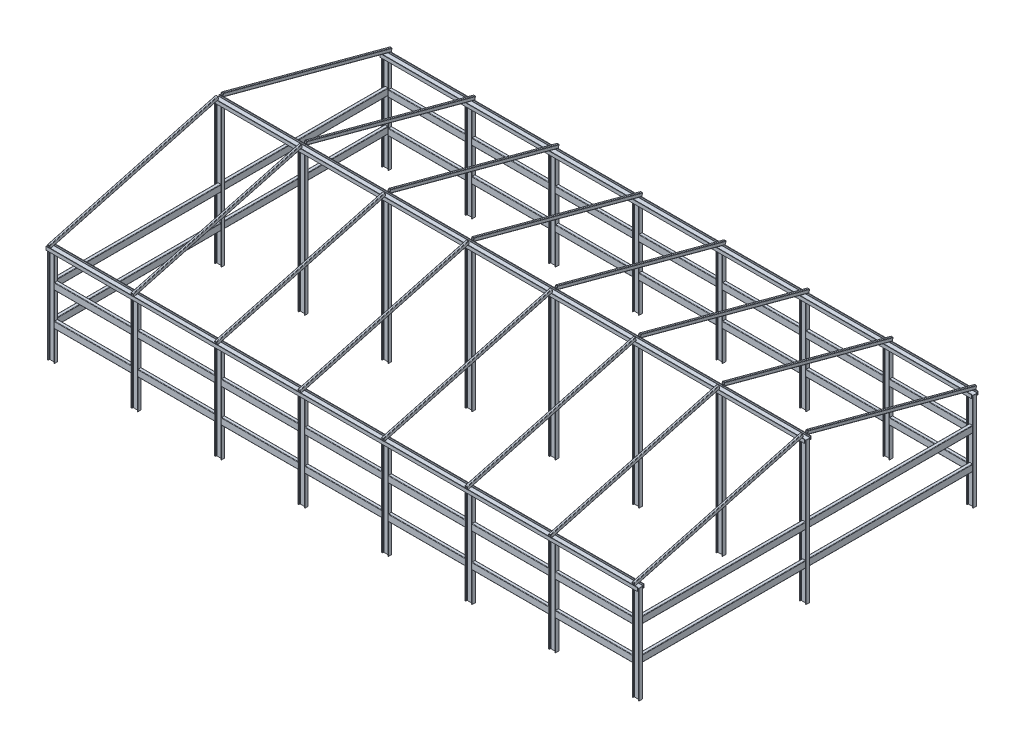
SolidWorks part; units mm, degrees
ref_plane "Front" through (0, 0, 0) normal (0, 0, 1) x (1, 0, 0)
ref_plane "Base Plane" through (0, 0, 0) normal (0, 1, 0) x (1, 0, 0)
ref_plane "Back Plane" through (0, 0, 0) normal (1, 0, 0) x (0, 0, -1)
sketch "Sketch1" plane through (0, 0, 0) normal (0, 1, 0) x (1, 0, 0)
  point P0 (0, 0)
  point P3 (21000, 3000)
  point P4 (3000, 0)
  point P5 (21000, 9000)
  point P6 (6000, 0)
  point P7 (9000, 0)
  point P8 (12000, 0)
  point P9 (15000, 0)
  point P10 (18000, 0)
  point P11 (21000, 0)
  point P12 (6000, 3000)
  point P13 (9000, 3000)
  point P14 (12000, 3000)
  point P15 (15000, 3000)
  point P16 (18000, 3000)
  point P17 (3000, 9000)
  point P19 (3000, 6000)
  point P20 (6000, 6000)
  point P21 (9000, 6000)
  point P23 (12000, 6000)
  point P24 (15000, 6000)
  point P25 (18000, 6000)
  point P26 (21000, 6000)
  point P27 (6000, 9000)
  point P28 (9000, 9000)
  point P29 (12000, 9000)
  point P30 (15000, 9000)
  point P31 (18000, 9000)
  point P32 (0, 3000)
  point P35 (0, 6000)
  point P37 (0, 12000)
  point P38 (3000, 12000)
  point P39 (6000, 12000)
  point P40 (9000, 12000)
  point P41 (12000, 12000)
  point P42 (15000, 12000)
  point P43 (18000, 12000)
  point P44 (21000, 12000)
  point P45 (3000, 3000)
  point P46 (0, 9000)
  dimension "D1" = 8
  dimension "D2" = 5
ref_plane "Front plane" through (21000, 0, 0) normal (1, 0, 0) x (0, 0, -1)
sketch "Sketch15" plane through (0, 0, 0) normal (1, 0, 0) x (0, 0, -1)
  line L0 (0, 3500) -> (6000, 5107.6952)
  line L1 (6000, 5107.6952) -> (12000, 3500)
  line L2 (6000, 1650) -> (6000, -1650) construction
  line L3 (0, 50) -> (0, -50) construction
  dimension "D1" = 75
surface "Roof Surface 1" sketch "Sketch15"
sketch "Sketch124" plane through (21000, 0, 0) normal (1, 0, 0) x (0, 0, -1)
  line L0 (6000, 1650) -> (6000, -1650) construction
  line L1 (-120, 3557.977) -> (-120, 0) construction
  line L2 (-120, 3557.977) -> (5880, 5167.6952)
  line L3 (5880, 5214.4961) -> (5880, 5056.8765) construction
  line L4 (12120, 3557.977) -> (6120, 5167.6952)
  line L5 (6120, 5214.4961) -> (6120, 5056.8765) construction
  line L6 (5880, 5167.6952) -> (5928.2922, 5180.6513)
  line L7 (6120, 5167.6952) -> (6071.7078, 5180.6513)
  point P0 (-120, 3557.977)
  point P1 (6000, 5167.7)
  point P2 (6000, 0)
  dimension "D1" = 3560
  dimension "D2" = 5167.7
  dimension "D3" = 6120
  dimension "D4" = 120
  dimension "D5" = 120
  dimension "D6" = 60
  dimension "D7" = 60
  dimension "D8" = 50
  dimension "D9" = 50
surface "Roof Surface 2" sketch "Sketch124" parameters "D1"=21277, "D2"=50
ref_plane "Top plane" through (0, 3500, 0) normal (0, 1, 0) x (1, 0, 0)
ref_plane "Central Plane" through (0, 0, -6000) normal (0, 0, 1) x (1, 0, 0)
ref_plane "Summit Plane" through (0, 5107.6952, 0) normal (0, 1, 0) x (1, 0, 0)
sketch "Sketch3" plane through (0, 3500, 0) normal (0, 1, 0) x (1, 0, 0)
  point P0 (6000, 6000)
  point P2 (9000, 6000)
  point P4 (12000, 6000)
  point P6 (15000, 6000)
  point P8 (18000, 6000)
  point P10 (21000, 6000)
  point P12 (21000, 3000)
  point P14 (15000, 0)
  point P16 (18000, 0)
  point P18 (21000, 0)
  point P20 (12000, 0)
  point P22 (9000, 0)
  point P24 (6000, 0)
  point P26 (3000, 0)
  point P28 (0, 0)
  point P30 (0, 3000)
  point P32 (3000, 6000)
  point P34 (0, 6000)
  point P36 (0, 9000)
  point P38 (21000, 9000)
  point P40 (0, 12000)
  point P42 (3000, 12000)
  point P44 (6000, 12000)
  point P46 (9000, 12000)
  point P48 (12000, 12000)
  point P50 (15000, 12000)
  point P52 (18000, 12000)
  point P54 (21000, 12000)
ref_plane "V Intermediate Plane 1" through (18000, 0, 0) normal (1, 0, 0) x (0, 0, -1)
ref_plane "V Intermediate Plane 2" through (15000, 0, 0) normal (1, 0, 0) x (0, 0, -1)
ref_plane "V Intermediate Plane 3" through (12000, 0, 0) normal (1, 0, 0) x (0, 0, -1)
ref_plane "V Intermediate Plane 4" through (9000, 0, 0) normal (1, 0, 0) x (0, 0, -1)
ref_plane "V Intermediate Plane 5" through (6000, 0, 0) normal (1, 0, 0) x (0, 0, -1)
ref_plane "V Intermediate Plane 6" through (3000, 0, 0) normal (1, 0, 0) x (0, 0, -1)
ref_plane "H Intermediate Plane 1" through (0, 2400, 0) normal (0, 1, 0) x (1, 0, 0)
ref_plane "H Intermediate Plane 2" through (0, 1200, 0) normal (0, 1, 0) x (1, 0, 0)
ref_plane "Plane30" through (21000, 3615.9276, 135.5474) normal (0, -0.2591, 0.9658) x (1, 0, 0)
sketch "Sketch139" plane through (21000, 3615.9276, 135.5474) normal (0, -0.2591, 0.9658) x (1, 0, 0)
  line L0 (-24, -52) -> (24, -52)
  line L1 (-32, -44) -> (-32, 44)
  line L2 (24, 52) -> (-24, 52)
  line L3 (32, 44) -> (32, -44)
  line L4 (-24, -60) -> (24, -60)
  line L5 (-40, -44) -> (-40, 44)
  line L6 (24, 60) -> (-24, 60)
  line L7 (40, 44) -> (40, -44)
  arc A0 (40, 44) -> (24, 60) centre (24, 44) ccw
  arc A1 (24, -60) -> (40, -44) centre (24, -44) ccw
  arc A2 (-40, -44) -> (-24, -60) centre (-24, -44) ccw
  arc A3 (-24, 60) -> (-40, 44) centre (-24, 44) ccw
  arc A4 (-24, 52) -> (-32, 44) centre (-24, 44) ccw
  arc A5 (32, 44) -> (24, 52) centre (24, 44) ccw
  arc A6 (24, -52) -> (32, -44) centre (24, -44) ccw
  arc A7 (-32, -44) -> (-24, -52) centre (-24, -44) ccw
  point P0 (0, 60)
  point P1 (40, 0)
  point P2 (0, -60)
  point P3 (-40, 0)
  point P4 (-40, 60)
  point P5 (40, 60)
  point P6 (40, -60)
  point P7 (-40, -60)
  point P8 (0, 0)
  point P33 (0, 0)
  dimension "D1" = 16
  dimension "Thickness" = 8
  dimension "V_leg" = 120
  dimension "H_leg" = 80
other "Structure System1"
sketch3d "Structure System Grid7"
  line L0 (21000, 0, -12000) -> (21000, 3500, -12000)
  line L1 (18000, 0, -12000) -> (18000, 3500, -12000)
  line L2 (15000, 0, -12000) -> (15000, 3500, -12000)
  line L3 (12000, 0, -12000) -> (12000, 3500, -12000)
  line L4 (9000, 0, -12000) -> (9000, 3500, -12000)
  line L5 (6000, 0, -12000) -> (6000, 3500, -12000)
  line L6 (3000, 0, -12000) -> (3000, 3500, -12000)
  line L7 (0, 0, -12000) -> (0, 3500, -12000)
  line L8 (21000, 0, 0) -> (21000, 3500, 0)
  line L9 (18000, 0, 0) -> (18000, 3500, 0)
  line L10 (15000, 0, 0) -> (15000, 3500, 0)
  line L11 (12000, 0, 0) -> (12000, 3500, 0)
  line L12 (9000, 0, 0) -> (9000, 3500, 0)
  line L13 (6000, 0, 0) -> (6000, 3500, 0)
  line L14 (3000, 0, 0) -> (3000, 3500, 0)
  line L15 (0, 0, 0) -> (0, 3500, 0)
  line L16 (21000, 5107.6952, -6000) -> (21000, 0, -6000)
  line L17 (18000, 5107.6952, -6000) -> (18000, 0, -6000)
  line L18 (15000, 5107.6952, -6000) -> (15000, 0, -6000)
  line L19 (12000, 5107.6952, -6000) -> (12000, 0, -6000)
  line L20 (9000, 5107.6952, -6000) -> (9000, 0, -6000)
  line L21 (6000, 5107.6952, -6000) -> (6000, 0, -6000)
  line L22 (3000, 5107.6952, -6000) -> (3000, 0, -6000)
  line L23 (0, 5107.6952, -6000) -> (0, 0, -6000)
  line L24 (21000, 2400, 0) -> (21000, 2400, -6000)
  line L25 (21000, 1200, 0) -> (21000, 1200, -6000)
  line L26 (21000, 2400, -6000) -> (21000, 2400, -12000)
  line L27 (21000, 1200, -6000) -> (21000, 1200, -12000)
  line L28 (21000, 2400, -12000) -> (18000, 2400, -12000)
  line L29 (21000, 1200, -12000) -> (18000, 1200, -12000)
  line L30 (18000, 2400, -12000) -> (15000, 2400, -12000)
  line L31 (18000, 1200, -12000) -> (15000, 1200, -12000)
  line L32 (15000, 2400, -12000) -> (12000, 2400, -12000)
  line L33 (15000, 1200, -12000) -> (12000, 1200, -12000)
  line L34 (12000, 2400, -12000) -> (9000, 2400, -12000)
  line L35 (12000, 1200, -12000) -> (9000, 1200, -12000)
  line L36 (9000, 2400, -12000) -> (6000, 2400, -12000)
  line L37 (9000, 1200, -12000) -> (6000, 1200, -12000)
  line L38 (6000, 2400, -12000) -> (3000, 2400, -12000)
  line L39 (6000, 1200, -12000) -> (3000, 1200, -12000)
  line L40 (3000, 2400, -12000) -> (0, 2400, -12000)
  line L41 (3000, 1200, -12000) -> (0, 1200, -12000)
  line L42 (0, 2400, -12000) -> (0, 2400, -6000)
  line L43 (0, 1200, -12000) -> (0, 1200, -6000)
  line L44 (0, 2400, -6000) -> (0, 2400, 0)
  line L45 (0, 1200, -6000) -> (0, 1200, 0)
  line L46 (0, 2400, 0) -> (3000, 2400, 0)
  line L47 (0, 1200, 0) -> (3000, 1200, 0)
  line L48 (3000, 2400, 0) -> (6000, 2400, 0)
  line L49 (3000, 1200, 0) -> (6000, 1200, 0)
  line L50 (6000, 2400, 0) -> (9000, 2400, 0)
  line L51 (6000, 1200, 0) -> (9000, 1200, 0)
  line L52 (9000, 2400, 0) -> (12000, 2400, 0)
  line L53 (9000, 1200, 0) -> (12000, 1200, 0)
  line L54 (12000, 2400, 0) -> (15000, 2400, 0)
  line L55 (12000, 1200, 0) -> (15000, 1200, 0)
  line L56 (15000, 2400, 0) -> (18000, 2400, 0)
  line L57 (15000, 1200, 0) -> (18000, 1200, 0)
  line L58 (18000, 2400, 0) -> (21000, 2400, 0)
  line L59 (18000, 1200, 0) -> (21000, 1200, 0)
  line L61 (-120, 5107.6952, -6000) -> (21120, 5107.6952, -6000)
  line L62 (-120, 3500, -12000) -> (21120, 3500, -12000)
  line L63 (21000, 3615.9276, 135.5474) -> (21000, 5238.602, -5912.7448)
  line L64 (21000, 5238.602, -6087.2552) -> (21000, 3615.9276, -12135.5474)
  line L65 (18000, 3615.9276, 135.5474) -> (18000, 5238.602, -5912.7448)
  line L66 (18000, 5238.602, -6087.2552) -> (18000, 3615.9276, -12135.5474)
  line L67 (15000, 3615.9276, 135.5474) -> (15000, 5238.602, -5912.7448)
  line L68 (15000, 5238.602, -6087.2552) -> (15000, 3615.9276, -12135.5474)
  line L69 (12000, 3615.9276, 135.5474) -> (12000, 5238.602, -5912.7448)
  line L70 (12000, 5238.602, -6087.2552) -> (12000, 3615.9276, -12135.5474)
  line L71 (9000, 3615.9276, 135.5474) -> (9000, 5238.602, -5912.7448)
  line L72 (9000, 5238.602, -6087.2552) -> (9000, 3615.9276, -12135.5474)
  line L73 (6000, 3615.9276, 135.5474) -> (6000, 5238.602, -5912.7448)
  line L74 (6000, 5238.602, -6087.2552) -> (6000, 3615.9276, -12135.5474)
  line L75 (3000, 3615.9276, 135.5474) -> (3000, 5238.602, -5912.7448)
  line L76 (3000, 5238.602, -6087.2552) -> (3000, 3615.9276, -12135.5474)
  line L77 (0, 3615.9276, 135.5474) -> (0, 5238.602, -5912.7448)
  line L78 (0, 5238.602, -6087.2552) -> (0, 3615.9276, -12135.5474)
  line L79 (-120, 3500, 0) -> (21120, 3500, 0)
  line L80 (-120, 5107.6952, -6000) -> (21120, 5107.6952, -6000)
  line L81 (-120, 3500, -12000) -> (21120, 3500, -12000)
  line L83 (21000, 5238.602, -6087.2552) -> (21000, 3615.9276, -12135.5474)
  line L84 (18000, 3615.9276, 135.5474) -> (18000, 5238.602, -5912.7448)
  line L85 (18000, 5238.602, -6087.2552) -> (18000, 3615.9276, -12135.5474)
  line L86 (15000, 3615.9276, 135.5474) -> (15000, 5238.602, -5912.7448)
  line L87 (15000, 5238.602, -6087.2552) -> (15000, 3615.9276, -12135.5474)
  line L88 (12000, 3615.9276, 135.5474) -> (12000, 5238.602, -5912.7448)
  line L89 (12000, 5238.602, -6087.2552) -> (12000, 3615.9276, -12135.5474)
  line L90 (9000, 3615.9276, 135.5474) -> (9000, 5238.602, -5912.7448)
  line L91 (9000, 5238.602, -6087.2552) -> (9000, 3615.9276, -12135.5474)
  line L92 (6000, 3615.9276, 135.5474) -> (6000, 5238.602, -5912.7448)
  line L93 (6000, 5238.602, -6087.2552) -> (6000, 3615.9276, -12135.5474)
  line L94 (3000, 3615.9276, 135.5474) -> (3000, 5238.602, -5912.7448)
  line L95 (3000, 5238.602, -6087.2552) -> (3000, 3615.9276, -12135.5474)
  line L96 (0, 3615.9276, 135.5474) -> (0, 5238.602, -5912.7448)
  line L97 (0, 5238.602, -6087.2552) -> (0, 3615.9276, -12135.5474)
other "<iso><sb beam><240X24>(3)"
ref_plane "Plane28" through (21000, 0, -12000) normal (0, 1, 0) x (0, 0, -1)
sketch "Sketch137" plane through (21000, 0, -12000) normal (0, 1, 0) x (0, 0, -1)
  line L0 (-60, -120) -> (-60, -105.666)
  line L1 (-56.6576, -101.7204) -> (-18.6847, -95.3911)
  line L2 (-12, -87.5) -> (-12, 87.5)
  line L3 (-18.6847, 95.3911) -> (-56.6576, 101.7204)
  line L4 (-60, 105.666) -> (-60, 120)
  line L5 (-60, 120) -> (60, 120)
  line L6 (60, 120) -> (60, 105.666)
  line L7 (56.6576, 101.7204) -> (18.6847, 95.3911)
  line L8 (12, 87.5) -> (12, -87.5)
  line L9 (18.6847, -95.3911) -> (56.6576, -101.7204)
  line L10 (60, -105.666) -> (60, -120)
  line L11 (60, -120) -> (-60, -120)
  line L15 (-12, 0) -> (12, 0) construction
  arc A0 (-18.6847, -95.3911) -> (-12, -87.5) centre (-20, -87.5) ccw
  arc A1 (-12, 87.5) -> (-18.6847, 95.3911) centre (-20, 87.5) ccw
  arc A2 (18.6847, 95.3911) -> (12, 87.5) centre (20, 87.5) ccw
  arc A3 (12, -87.5) -> (18.6847, -95.3911) centre (20, -87.5) ccw
  arc A4 (-56.6576, 101.7204) -> (-60, 105.666) centre (-56, 105.666) cw
  arc A5 (56.6576, 101.7204) -> (60, 105.666) centre (56, 105.666) ccw
  arc A6 (-60, -105.666) -> (-56.6576, -101.7204) centre (-56, -105.666) cw
  arc A7 (60, -105.666) -> (56.6576, -101.7204) centre (56, -105.666) ccw
  point P1 (0, 120)
  point P8 (0, -120)
  point P21 (0, 0)
  point P34 (0, 0)
  dimension "RI" = 8
  dimension "D3" = 4
  dimension "BF" = 120
  dimension "D2" = 9.463
  dimension "DEPTH" = 240
  dimension "TW" = 24
  dimension "D1" = 175
other "Member175"
other "Member176"
other "Member177"
other "Member178"
other "Member179"
other "Member180"
other "Member181"
other "Member182"
other "Member183"
other "Member184"
other "Member185"
other "Member186"
other "Member187"
other "Member188"
other "Member189"
other "Member190"
other "Member191"
other "Member192"
other "Member193"
other "Member194"
other "Member195"
other "Member196"
other "Member197"
other "Member198"
other "Member236" [suppressed]
other "Member237" [suppressed]
other "Member254"
other "Member255"
other "Member256"
other "<iso><rectangular tube><240 X 120 X 12>(3)"
ref_plane "Plane29" through (21000, 2400, 0) normal (0, 0, -1) x (-1, 0, 0)
sketch "Sketch138" plane through (21000, 2400, 0) normal (0, 0, -1) x (-1, 0, 0)
  line L0 (-44, -108) -> (44, -108)
  line L1 (-48, -104) -> (-48, 104)
  line L2 (44, 108) -> (-44, 108)
  line L3 (48, 104) -> (48, -104)
  line L4 (-44, -120) -> (44, -120)
  line L5 (-60, -104) -> (-60, 104)
  line L6 (44, 120) -> (-44, 120)
  line L7 (60, 104) -> (60, -104)
  arc A0 (60, 104) -> (44, 120) centre (44, 104) ccw
  arc A1 (44, -120) -> (60, -104) centre (44, -104) ccw
  arc A2 (-60, -104) -> (-44, -120) centre (-44, -104) ccw
  arc A3 (-44, 120) -> (-60, 104) centre (-44, 104) ccw
  arc A4 (-44, 108) -> (-48, 104) centre (-44, 104) ccw
  arc A5 (48, 104) -> (44, 108) centre (44, 104) ccw
  arc A6 (44, -108) -> (48, -104) centre (44, -104) ccw
  arc A7 (-48, -104) -> (-44, -108) centre (-44, -104) ccw
  point P0 (0, 120)
  point P1 (60, 0)
  point P2 (0, -120)
  point P3 (-60, 0)
  point P4 (-60, 120)
  point P5 (60, 120)
  point P6 (60, -120)
  point P7 (-60, -120)
  point P8 (0, 0)
  point P33 (0, 0)
  dimension "D1" = 16
  dimension "Thickness" = 12
  dimension "V_leg" = 240
  dimension "H_leg" = 120
other "Member199"
other "Member200"
other "Member201"
other "Member202"
other "Member203"
other "Member204"
other "Member205"
other "Member206"
other "Member207"
other "Member208"
other "Member209"
other "Member210"
other "Member211"
other "Member212"
other "Member213"
other "Member214"
other "Member215"
other "Member216"
other "Member217"
other "Member218"
other "Member219"
other "Member220"
other "Member221"
other "Member222"
other "Member223"
other "Member224"
other "Member225"
other "Member226"
other "Member227"
other "Member228"
other "Member229"
other "Member230"
other "Member231"
other "Member232"
other "Member233"
other "Member234"
other "<iso><rectangular tube><120 x 80 x 8>(4)"
other "Member238"
other "Member239"
other "Member240"
other "Member241"
other "Member242"
other "Member243"
other "Member244"
other "Member245"
other "Member246"
other "Member247"
other "Member248"
other "Member249"
other "Member250"
other "Member251"
other "Member252"
other "Member253"
other "<iso><rectangular tube><120 x 80 x 8>(5)"
ref_plane "Plane32" through (21000, 5238.602, -6087.2552) normal (0, 0.2591, 0.9658) x (1, 0, 0)
sketch "Sketch142" plane through (21000, 5238.602, -6087.2552) normal (0, 0.2591, 0.9658) x (1, 0, 0)
  line L0 (-24, -52) -> (24, -52)
  line L1 (-32, -44) -> (-32, 44)
  line L2 (24, 52) -> (-24, 52)
  line L3 (32, 44) -> (32, -44)
  line L4 (-24, -60) -> (24, -60)
  line L5 (-40, -44) -> (-40, 44)
  line L6 (24, 60) -> (-24, 60)
  line L7 (40, 44) -> (40, -44)
  arc A0 (40, 44) -> (24, 60) centre (24, 44) ccw
  arc A1 (24, -60) -> (40, -44) centre (24, -44) ccw
  arc A2 (-40, -44) -> (-24, -60) centre (-24, -44) ccw
  arc A3 (-24, 60) -> (-40, 44) centre (-24, 44) ccw
  arc A4 (-24, 52) -> (-32, 44) centre (-24, 44) ccw
  arc A5 (32, 44) -> (24, 52) centre (24, 44) ccw
  arc A6 (24, -52) -> (32, -44) centre (24, -44) ccw
  arc A7 (-32, -44) -> (-24, -52) centre (-24, -44) ccw
  point P0 (0, 60)
  point P1 (40, 0)
  point P2 (0, -60)
  point P3 (-40, 0)
  point P4 (-40, 60)
  point P5 (40, 60)
  point P6 (40, -60)
  point P7 (-40, -60)
  point P8 (0, 0)
  point P33 (0, 0)
  dimension "D1" = 16
  dimension "Thickness" = 8
  dimension "V_leg" = 120
  dimension "H_leg" = 80
other "Member258"
other "Member259"
other "Member260"
other "Member261"
other "Member262"
other "Member263"
other "Member264"
other "Member265"
other "Member266"
other "Member267"
other "Member268"
other "Member269"
other "Member270"
other "Member271"
other "Member272"
other "Corner Management1"
other "Complex Corner Group3"
other "Corner121"
other "Corner122"
other "Corner123"
other "Corner124"
other "Corner125"
other "Corner126"
other "Corner127"
other "Corner128"
other "Corner129"
other "Corner130" [suppressed]
other "Corner131"
other "Corner132"
other "Corner133"
other "Corner134"
other "Corner135"
other "Corner136" [suppressed]
other "Corner137"
other "Corner138"
other "Corner139" [suppressed]
other "Corner140" [suppressed]
other "Corner141"
other "Corner142"
other "Corner143"
other "Corner144" [suppressed]
other "Corner145" [suppressed]
other "Corner146"
other "Corner147"
other "Corner148"
other "Corner149" [suppressed]
other "Corner150"
other "Corner151"
other "Corner152"
other "Corner153"
other "Corner154"
other "Corner155"
other "Corner156"
other "Simple Corner Group3"
other "Corner157" [suppressed]
other "Corner158" [suppressed]
other "Corner163" [suppressed]
other "Corner164" [suppressed]
other "Corner165" [suppressed]
other "Corner166" [suppressed]
other "Corner167" [suppressed]
other "Corner168" [suppressed]
other "Corner172" [suppressed]
other "Corner173" [suppressed]
other "Corner174" [suppressed]
other "Corner175" [suppressed]
other "Corner176" [suppressed]
other "Corner177" [suppressed]
other "Corner178" [suppressed]
other "Corner180" [suppressed]
other "Corner181"
other "Corner182"
other "Corner183"
other "Corner184"
other "Corner185"
other "Corner186"
other "Corner187"
other "Corner188"
other "Corner189"
other "Corner190"
other "Corner191"
other "Corner192"
other "Corner193"
other "Corner194"
other "Corner195"
other "Corner196"
other "Corner197"
other "Corner198"
other "Corner199"
other "Corner200"
other "Corner201"
other "Corner202"
other "Corner203"
other "Corner204"
other "Structure System2"
sketch3d "Structure System Grid8"
  line L0 (18000, 0, 0) -> (18000, 3500, 0)
  line L1 (15000, 0, 0) -> (15000, 3500, 0)
  line L2 (12000, 0, 0) -> (12000, 3500, 0)
  line L3 (9000, 0, 0) -> (9000, 3500, 0)
  line L4 (6000, 0, 0) -> (6000, 3500, 0)
  line L5 (3000, 0, 0) -> (3000, 3500, 0)
  line L6 (0, 0, 0) -> (0, 3500, 0)
  line L7 (21000, 0, -12000) -> (21000, 3500, -12000)
  line L8 (18000, 0, -12000) -> (18000, 3500, -12000)
  line L9 (15000, 0, -12000) -> (15000, 3500, -12000)
  line L10 (12000, 0, -12000) -> (12000, 3500, -12000)
  line L11 (9000, 0, -12000) -> (9000, 3500, -12000)
  line L12 (6000, 0, -12000) -> (6000, 3500, -12000)
  line L13 (3000, 0, -12000) -> (3000, 3500, -12000)
  line L14 (0, 0, -12000) -> (0, 3500, -12000)
  line L15 (21000, 0, 0) -> (21000, 3500, 0)
  line L16 (21000, 0, -6000) -> (21000, 5107.6952, -6000)
  line L17 (18000, 0, -6000) -> (18000, 5107.6952, -6000)
  line L18 (15000, 0, -6000) -> (15000, 5107.6952, -6000)
  line L19 (12000, 0, -6000) -> (12000, 5107.6952, -6000)
  line L20 (9000, 0, -6000) -> (9000, 5107.6952, -6000)
  line L21 (6000, 0, -6000) -> (6000, 5107.6952, -6000)
  line L22 (3000, 0, -6000) -> (3000, 5107.6952, -6000)
  line L23 (0, 0, -6000) -> (0, 5107.6952, -6000)
  line L24 (21000, 2400, 0) -> (21000, 2400, -6000)
  line L25 (21000, 1200, 0) -> (21000, 1200, -6000)
  line L26 (21000, 2400, -6000) -> (21000, 2400, -12000)
  line L27 (21000, 1200, -6000) -> (21000, 1200, -12000)
  line L28 (21000, 2400, -12000) -> (18000, 2400, -12000)
  line L29 (21000, 1200, -12000) -> (18000, 1200, -12000)
  line L30 (18000, 2400, -12000) -> (15000, 2400, -12000)
  line L31 (18000, 1200, -12000) -> (15000, 1200, -12000)
  line L32 (15000, 2400, -12000) -> (12000, 2400, -12000)
  line L33 (15000, 1200, -12000) -> (12000, 1200, -12000)
  line L34 (12000, 2400, -12000) -> (9000, 2400, -12000)
  line L35 (12000, 1200, -12000) -> (9000, 1200, -12000)
  line L36 (9000, 2400, -12000) -> (6000, 2400, -12000)
  line L37 (9000, 1200, -12000) -> (6000, 1200, -12000)
  line L38 (6000, 2400, -12000) -> (3000, 2400, -12000)
  line L39 (6000, 1200, -12000) -> (3000, 1200, -12000)
  line L40 (3000, 2400, -12000) -> (0, 2400, -12000)
  line L41 (3000, 1200, -12000) -> (0, 1200, -12000)
  line L42 (0, 2400, -12000) -> (0, 2400, -6000)
  line L43 (0, 1200, -12000) -> (0, 1200, -6000)
  line L44 (0, 2400, -6000) -> (0, 2400, 0)
  line L45 (0, 1200, -6000) -> (0, 1200, 0)
  line L46 (0, 2400, 0) -> (3000, 2400, 0)
  line L47 (0, 1200, 0) -> (3000, 1200, 0)
  line L48 (3000, 2400, 0) -> (6000, 2400, 0)
  line L49 (3000, 1200, 0) -> (6000, 1200, 0)
  line L50 (6000, 2400, 0) -> (9000, 2400, 0)
  line L51 (6000, 1200, 0) -> (9000, 1200, 0)
  line L52 (9000, 2400, 0) -> (12000, 2400, 0)
  line L53 (9000, 1200, 0) -> (12000, 1200, 0)
  line L54 (12000, 2400, 0) -> (15000, 2400, 0)
  line L55 (12000, 1200, 0) -> (15000, 1200, 0)
  line L56 (15000, 2400, 0) -> (18000, 2400, 0)
  line L57 (15000, 1200, 0) -> (18000, 1200, 0)
  line L58 (18000, 2400, 0) -> (21000, 2400, 0)
  line L59 (18000, 1200, 0) -> (21000, 1200, 0)
  line L60 (-120, 3500, 0) -> (21120, 3500, 0)
  line L61 (-120, 5107.6952, -6000) -> (21120, 5107.6952, -6000)
  line L62 (-120, 3500, -12000) -> (21120, 3500, -12000)
  line L63 (21000, 3615.9276, 135.5474) -> (21000, 5238.602, -5912.7448)
  line L64 (21000, 5238.602, -6087.2552) -> (21000, 3615.9276, -12135.5474)
  line L65 (18000, 3615.9276, 135.5474) -> (18000, 5238.602, -5912.7448)
  line L66 (18000, 5238.602, -6087.2552) -> (18000, 3615.9276, -12135.5474)
  line L67 (15000, 3615.9276, 135.5474) -> (15000, 5238.602, -5912.7448)
  line L68 (15000, 5238.602, -6087.2552) -> (15000, 3615.9276, -12135.5474)
  line L69 (12000, 3615.9276, 135.5474) -> (12000, 5238.602, -5912.7448)
  line L70 (12000, 5238.602, -6087.2552) -> (12000, 3615.9276, -12135.5474)
  line L71 (9000, 3615.9276, 135.5474) -> (9000, 5238.602, -5912.7448)
  line L72 (9000, 5238.602, -6087.2552) -> (9000, 3615.9276, -12135.5474)
  line L73 (6000, 3615.9276, 135.5474) -> (6000, 5238.602, -5912.7448)
  line L74 (6000, 5238.602, -6087.2552) -> (6000, 3615.9276, -12135.5474)
  line L75 (3000, 3615.9276, 135.5474) -> (3000, 5238.602, -5912.7448)
  line L76 (3000, 5238.602, -6087.2552) -> (3000, 3615.9276, -12135.5474)
  line L77 (0, 3615.9276, 135.5474) -> (0, 5238.602, -5912.7448)
  line L78 (0, 5238.602, -6087.2552) -> (0, 3615.9276, -12135.5474)
other "<iso><sb beam><240X24>(4)"
ref_plane "Plane34" through (18000, 0, 0) normal (0, 1, 0) x (0, 0, -1)
sketch "Sketch144" plane through (18000, 0, 0) normal (0, 1, 0) x (0, 0, -1)
  line L0 (-60, -120) -> (-60, -105.666)
  line L1 (-56.6576, -101.7204) -> (-18.6847, -95.3911)
  line L2 (-12, -87.5) -> (-12, 87.5)
  line L3 (-18.6847, 95.3911) -> (-56.6576, 101.7204)
  line L4 (-60, 105.666) -> (-60, 120)
  line L5 (-60, 120) -> (60, 120)
  line L6 (60, 120) -> (60, 105.666)
  line L7 (56.6576, 101.7204) -> (18.6847, 95.3911)
  line L8 (12, 87.5) -> (12, -87.5)
  line L9 (18.6847, -95.3911) -> (56.6576, -101.7204)
  line L10 (60, -105.666) -> (60, -120)
  line L11 (60, -120) -> (-60, -120)
  line L15 (-12, 0) -> (12, 0) construction
  arc A0 (-18.6847, -95.3911) -> (-12, -87.5) centre (-20, -87.5) ccw
  arc A1 (-12, 87.5) -> (-18.6847, 95.3911) centre (-20, 87.5) ccw
  arc A2 (18.6847, 95.3911) -> (12, 87.5) centre (20, 87.5) ccw
  arc A3 (12, -87.5) -> (18.6847, -95.3911) centre (20, -87.5) ccw
  arc A4 (-56.6576, 101.7204) -> (-60, 105.666) centre (-56, 105.666) cw
  arc A5 (56.6576, 101.7204) -> (60, 105.666) centre (56, 105.666) ccw
  arc A6 (-60, -105.666) -> (-56.6576, -101.7204) centre (-56, -105.666) cw
  arc A7 (60, -105.666) -> (56.6576, -101.7204) centre (56, -105.666) ccw
  point P1 (0, 120)
  point P8 (0, -120)
  point P21 (0, 0)
  point P34 (0, 0)
  dimension "RI" = 8
  dimension "D3" = 4
  dimension "BF" = 120
  dimension "D2" = 9.463
  dimension "DEPTH" = 240
  dimension "TW" = 24
  dimension "D1" = 175
other "Member273"
other "Member274"
other "Member275"
other "Member276"
other "Member277"
other "Member278"
other "Member279"
other "Member280"
other "Member281"
other "Member282"
other "Member283"
other "Member284"
other "Member285"
other "Member286"
other "Member287"
other "Member288"
other "Member289"
other "Member290"
other "Member291"
other "Member292"
other "Member293"
other "Member294"
other "Member295"
other "Member296"
other "Member333"
other "Member334"
other "Member335"
other "<iso><rectangular tube><240 X 120 X 12>(4)"
ref_plane "Plane35" through (21000, 2400, 0) normal (0, 0, -1) x (-1, 0, 0)
sketch "Sketch145" plane through (21000, 2400, 0) normal (0, 0, -1) x (-1, 0, 0)
  line L0 (-44, -108) -> (44, -108)
  line L1 (-48, -104) -> (-48, 104)
  line L2 (44, 108) -> (-44, 108)
  line L3 (48, 104) -> (48, -104)
  line L4 (-44, -120) -> (44, -120)
  line L5 (-60, -104) -> (-60, 104)
  line L6 (44, 120) -> (-44, 120)
  line L7 (60, 104) -> (60, -104)
  arc A0 (60, 104) -> (44, 120) centre (44, 104) ccw
  arc A1 (44, -120) -> (60, -104) centre (44, -104) ccw
  arc A2 (-60, -104) -> (-44, -120) centre (-44, -104) ccw
  arc A3 (-44, 120) -> (-60, 104) centre (-44, 104) ccw
  arc A4 (-44, 108) -> (-48, 104) centre (-44, 104) ccw
  arc A5 (48, 104) -> (44, 108) centre (44, 104) ccw
  arc A6 (44, -108) -> (48, -104) centre (44, -104) ccw
  arc A7 (-48, -104) -> (-44, -108) centre (-44, -104) ccw
  point P0 (0, 120)
  point P1 (60, 0)
  point P2 (0, -120)
  point P3 (-60, 0)
  point P4 (-60, 120)
  point P5 (60, 120)
  point P6 (60, -120)
  point P7 (-60, -120)
  point P8 (0, 0)
  point P33 (0, 0)
  dimension "D1" = 16
  dimension "Thickness" = 12
  dimension "V_leg" = 240
  dimension "H_leg" = 120
other "Member297"
other "Member298"
other "Member299"
other "Member300"
other "Member301"
other "Member302"
other "Member303"
other "Member304"
other "Member305"
other "Member306"
other "Member307"
other "Member308"
other "Member309"
other "Member310"
other "Member311"
other "Member312"
other "Member313"
other "Member314"
other "Member315"
other "Member316"
other "Member317"
other "Member318"
other "Member319"
other "Member320"
other "Member321"
other "Member322"
other "Member323"
other "Member324"
other "Member325"
other "Member326"
other "Member327"
other "Member328"
other "Member329"
other "Member330"
other "Member331"
other "Member332"
other "<iso><rectangular tube><120 x 80 x 8>(6)"
ref_plane "Plane36"
sketch "Sketch146" plane through (21000, 3615.9276, 135.5474) normal (0, -0.2591, 0.9658) x (1, 0, 0)
  line L0 (-24, -52) -> (24, -52)
  line L1 (-32, -44) -> (-32, 44)
  line L2 (24, 52) -> (-24, 52)
  line L3 (32, 44) -> (32, -44)
  line L4 (-24, -60) -> (24, -60)
  line L5 (-40, -44) -> (-40, 44)
  line L6 (24, 60) -> (-24, 60)
  line L7 (40, 44) -> (40, -44)
  arc A0 (40, 44) -> (24, 60) centre (24, 44) ccw
  arc A1 (24, -60) -> (40, -44) centre (24, -44) ccw
  arc A2 (-40, -44) -> (-24, -60) centre (-24, -44) ccw
  arc A3 (-24, 60) -> (-40, 44) centre (-24, 44) ccw
  arc A4 (-24, 52) -> (-32, 44) centre (-24, 44) ccw
  arc A5 (32, 44) -> (24, 52) centre (24, 44) ccw
  arc A6 (24, -52) -> (32, -44) centre (24, -44) ccw
  arc A7 (-32, -44) -> (-24, -52) centre (-24, -44) ccw
  point P0 (0, 60)
  point P1 (40, 0)
  point P2 (0, -60)
  point P3 (-40, 0)
  point P4 (-40, 60)
  point P5 (40, 60)
  point P6 (40, -60)
  point P7 (-40, -60)
  point P8 (0, 0)
  point P33 (0, 0)
  dimension "D1" = 16
  dimension "Thickness" = 8
  dimension "V_leg" = 120
  dimension "H_leg" = 80
other "Member336"
other "Member337"
other "Member338"
other "Member339"
other "Member340"
other "Member341"
other "Member342"
other "Member343"
other "Member344"
other "Member345"
other "Member346"
other "Member347"
other "Member348"
other "Member349"
other "Member350"
other "Member351"
other "Corner Management2"
other "Simple Corner Group4"
other "Corner205"
other "Corner206"
other "Corner207"
other "Corner209"
other "Corner210"
other "Corner211"
other "Corner212"
other "Corner213"
other "Corner214"
other "Corner215"
other "Corner216"
other "Corner217"
other "Corner218"
other "Corner219"
other "Corner220"
other "Corner221"
other "Corner222"
other "Corner223"
other "Corner224"
other "Corner225"
other "Corner226"
other "Corner227"
other "Corner228"
other "Corner229"
other "Complex Corner Group4"
other "Corner208"
other "Corner230"
other "Corner231"
other "Corner232"
other "Corner233"
other "Corner234"
other "Corner235"
other "Corner236"
other "Corner237"
other "Corner238"
other "Corner239"
other "Corner240"
other "Corner241"
other "Corner242"
other "Corner243"
other "Corner244"
other "Corner245"
other "Corner246"
other "Corner247"
other "Corner248"
other "Corner249"
other "Corner250"
other "Corner251"
other "Corner252"
other "Corner253"
other "Corner254"
other "Corner255"
other "Corner256"
other "Corner257"
other "Corner258"
other "Corner259"
other "Corner260"
other "Corner261"
other "Corner262"
other "Corner263"
other "Corner264"
